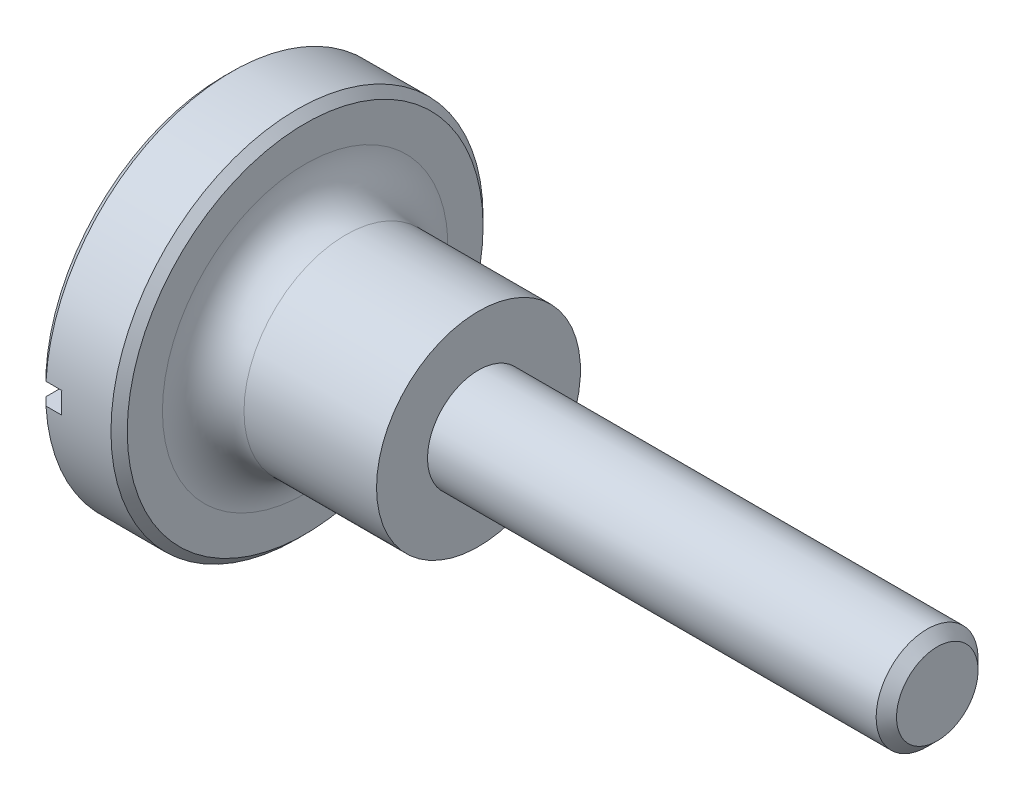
SolidWorks part; units mm, degrees
revolve "Base-Revolve" add sketch "BodySke" angle 360 about L2
sketch "BodySke" plane through (0, 0, 0) normal (0, 0, 1) x (1, 0, 0)
  line L0 (69, 5) -> (70, 4)
  line L1 (0, 0) -> (0, 17.45)
  line L2 (-25.4, 0) -> (127, 0) construction
  line L3 (70, 0) -> (0, 0)
  line L5 (70, 4) -> (70, 0)
  line L6 (0.8, 18.25) -> (7.2, 18.25)
  line L7 (4, 31.75) -> (4, -6.35) construction
  line L8 (0.8, 18.25) -> (0, 17.45)
  line L9 (10, 6.5875) -> (10, -2.9375) construction
  line L10 (30, 6.35) -> (30, -3.175) construction
  line L11 (7.2, 18.25) -> (8, 17.45)
  line L12 (8, 10) -> (25, 10)
  line L13 (25, 10) -> (25, 5)
  line L14 (25, 5) -> (69, 5)
  line L15 (8, 10) -> (8, 17.45)
  point P9 (70, 5)
ref_plane "Plane1" through (0, 0, 0) normal (0, 0, 1) x (1, 0, 0)
ref_plane "Plane2" through (0, 0, 0) normal (0, 1, 0) x (1, 0, 0)
ref_plane "Plane3" through (0, 0, 0) normal (1, 0, 0) x (0, 0, -1)
other "Configuration Table"
sketch "ThdSchSke" plane through (0, 0, 0) normal (0, 0, 1) x (1, 0, 0)
  line L0 (30, -4) -> (29.2998, -5)
  line L1 (30, -4) -> (30.7002, -5)
  line L2 (30.7002, -5) -> (30.7002, -6.25)
  line L3 (-3.175, 0) -> (5.1513, 0) construction
  line L5 (30.7002, -6.25) -> (29.2998, -6.25)
  line L6 (29.2998, -6.25) -> (29.2998, -5)
  line L7 (25, -10) -> (25, 10) construction
revolve "ThreadSchematic" [suppressed] cut sketch "ThdSchSke" angle 360 about L3
pattern_linear "ThdSchPat" [suppressed]
sketch "KnurlSke" plane through (0, 0, 0) normal (-1, 0, 0) x (0, 0, 1)
  line L0 (0, 17.65) -> (0, 3.175) construction
  line L1 (0, 17.65) -> (0.3445, 18.2467)
  line L2 (0, 17.65) -> (-0.3445, 18.2467)
  line L3 (0, 18.25) -> (0, 17.65) construction
  circle A0 centre (0, 0) radius 18.25 construction
  arc A1 (0.3445, 18.2467) -> (-0.3445, 18.2467) centre (0, 0) ccw
extrude "Knurl_cut" [suppressed] cut sketch "KnurlSke" against normal up to next
pattern_circular "Knurl" [suppressed] count 86 over 360 about axis through (-25.4, 0, 0) along (1, 0, 0)
sketch "SlotSke" plane through (0, 0, 0) normal (0, 0, 1) x (1, 0, 0)
  line L0 (2.3466, 1.0507) -> (-2.3466, -1.0507) construction
  line L1 (-2.3466, -1.0507) -> (2.3466, -1.0507)
  line L2 (-2.3466, -1.0507) -> (-2.3466, 1.0507)
  line L3 (-2.3466, 1.0507) -> (2.3466, 1.0507)
  line L4 (2.3466, -1.0507) -> (2.3466, 1.0507)
  dimension "Slot_dep" = 2.3466
  dimension "Slot_Wid" = 2.1014
extrude "Slot" cut sketch "SlotSke" against normal through all and the other way through all
fillet "Fillet1" radius 4 1 edges at (8, 0, 10)
equation "\"Thread_minor@ThreadCosmetic\" = \"Minor_dia@BodySke\""
equation "\"Thread_length@ThreadCosmetic\" = ((sgn( (\"Length@BodySke\" - \"Advance@BodySke\" * 2.0 ) - \"Thread_nom@BodySke\" )-1)*( (\"Length@BodySke\" - \"Advance@BodySke\" * 2.0 ) - \"Thread_nom@BodySke\" ))/-2+ \"Thread_"
equation "\"Thread_minor@ThdSchSke\" = \"Thread_minor@ThreadCosmetic\""
equation "\"Diameter@ThdSchSke\" = \"diameter@BodySke\""
equation "\"Overcut@ThdSchSke\" = \"diameter@BodySke\" * 1.25"
equation "\"Start@ThdSchSke\" =  \"Length@BodySke\" -  \"Thread_length@ThreadCosmetic\"  '---Non-countersunk---"
equation "\"Num_threads@ThdSchPat\" = int( \"Thread_length@ThreadCosmetic\" / \"Advance@BodySke\" + 0.999 )  + 1"
equation "\"Advance@ThdSchPat\" = \"Thread_length@ThreadCosmetic\" /  (\"Num_threads@ThdSchPat\" - 1) 'relax it"
equation "\"depth@KnurlSke\" = \"Chamfer@BodySke\" * 0.75"
equation "\"Count@Knurl\" = (3.141592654 / 2 * \"Head_dia@BodySke\") / \"depth@KnurlSke\" * 0.9"
